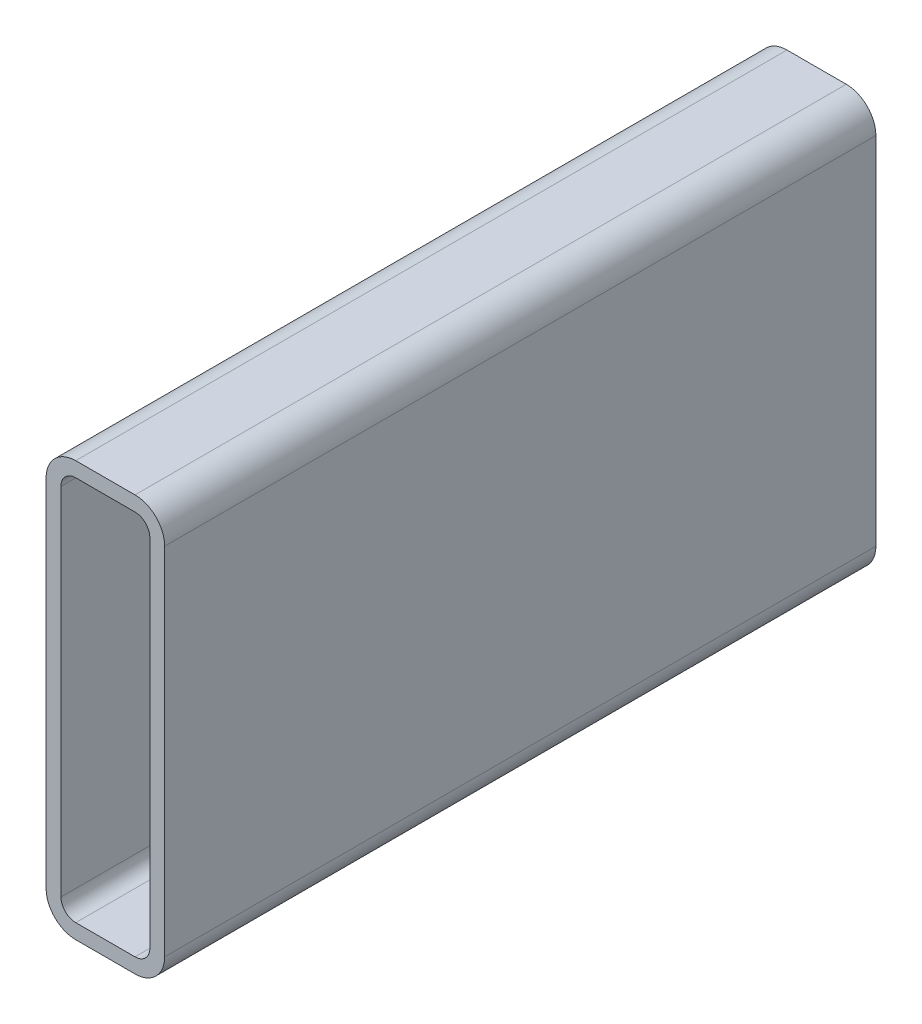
SolidWorks part; units mm, degrees
ref_plane "Front Plane" through (0, 0, 0) normal (0, 0, 1) x (1, 0, 0)
ref_plane "Top Plane" through (0, 0, 0) normal (0, 1, 0) x (1, 0, 0)
ref_plane "Right Plane" through (0, 0, 0) normal (1, 0, 0) x (0, 0, -1)
sketch "Sketch1" plane through (0, 0, 0) normal (0, 0, 1) x (1, 0, 0)
  line B0 (12.7, 177.8) -> (38.1, 177.8)
  arc B1 (50.8, 165.1) -> (38.1, 177.8) centre (38.1, 165.1) ccw
  line B2 (50.8, 165.1) -> (50.8, 12.7)
  arc B3 (38.1, 0) -> (50.8, 12.7) centre (38.1, 12.7) ccw
  line B4 (38.1, 0) -> (12.7, 0)
  arc B5 (0, 12.7) -> (12.7, 0) centre (12.7, 12.7) ccw
  line B6 (0, 12.7) -> (0, 165.1)
  arc B7 (12.7, 177.8) -> (0, 165.1) centre (12.7, 165.1) ccw
  line B8 (12.7, 171.45) -> (38.1, 171.45)
  arc B9 (44.45, 165.1) -> (38.1, 171.45) centre (38.1, 165.1) ccw
  line B10 (44.45, 165.1) -> (44.45, 12.7)
  arc B11 (38.1, 6.35) -> (44.45, 12.7) centre (38.1, 12.7) ccw
  line B12 (38.1, 6.35) -> (12.7, 6.35)
  arc B13 (6.35, 12.7) -> (12.7, 6.35) centre (12.7, 12.7) ccw
  line B14 (6.35, 12.7) -> (6.35, 165.1)
  arc B15 (12.7, 171.45) -> (6.35, 165.1) centre (12.7, 165.1) ccw
sketch_block_instance "HSS7x2x0.250-1"
sketch_block "HSS7x2x0.250"
extrude "Boss-Extrude1" add sketch "Sketch1" along normal blind 304.8
